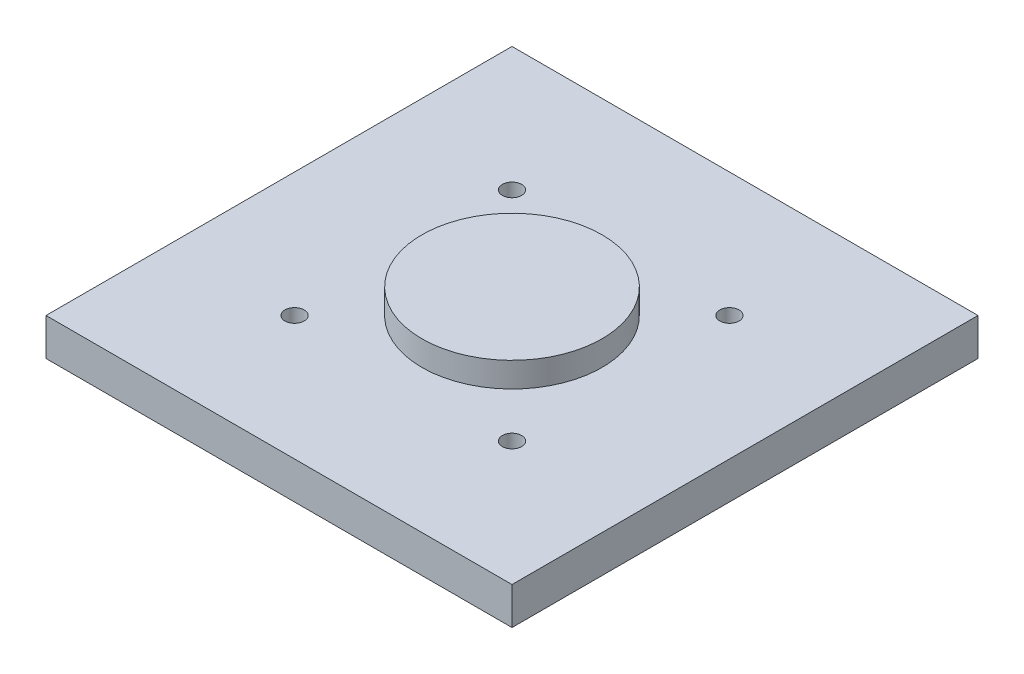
SolidWorks part; units mm, degrees
ref_plane "Plan de face" through (0, 0, 0) normal (0, 0, 1) x (1, 0, 0)
ref_plane "Plan de dessus" through (0, 0, 0) normal (0, 1, 0) x (1, 0, 0)
ref_plane "Plan de droite" through (0, 0, 0) normal (1, 0, 0) x (0, 0, -1)
sketch "Esquisse1" plane through (0, 0, 0) normal (0, 0, 1) x (1, 0, 0)
  line L1 (32.6923, -652.6923) -> (-342.3077, -652.6923)
  line L2 (32.6923, -652.6923) -> (32.6923, -682.6923)
  line L3 (32.6923, -682.6923) -> (-342.3077, -682.6923)
  line L4 (-342.3077, -652.6923) -> (-342.3077, -682.6923)
  line L5 (32.6923, -652.6923) -> (-342.3077, -682.6923) construction
  line L6 (32.6923, -682.6923) -> (-342.3077, -652.6923) construction
  point P0 (-154.8077, -667.6923)
  dimension "D1" = 30
  dimension "D2" = 375
extrude "Boss.-Extru.1" add sketch "Esquisse1" along normal blind 375
hole_wizard "Dégagement M141" positions "Esquisse12" profile "Esquisse9" hole size "M14" standard "ISO"
sketch "Esquisse12" plane through (0, -652.6923, 0) normal (0, 1, 0) x (1, 0, 0)
  line L0 (32.6923, -375) -> (32.6923, 0) construction
  line L1 (32.6923, -375) -> (-342.3077, -375) construction
  line L2 (32.6923, 0) -> (-342.3077, 0) construction
  line L3 (-342.3077, -375) -> (-342.3077, 0) construction
  point P0 (-67.3077, -100)
  point P2 (-242.3077, -100)
  point P4 (-242.3077, -275)
  point P6 (-67.3077, -275)
  dimension "D1" = 100
  dimension "D2" = 100
  dimension "D3" = 100
  dimension "D4" = 100
  dimension "D5" = 100
  dimension "D6" = 100
  dimension "D7" = 100
  dimension "D8" = 100
sketch "Esquisse9" plane through (-67.3077, -652.6923, 100) normal (1, 0, 0) x (0, 0, 1)
  line L0 (0, 0) -> (0, 30)
  line L1 (0, 30) -> (7.75, 30)
  line L2 (7.75, 30) -> (7.75, 0)
  line L5 (7.75, 0) -> (0, 0)
  line L11 (0, -6.35) -> (0, 107.95) construction
  dimension "Diamètre du perçage jusqu'au prochain" = 15.5
  dimension "Profondeur du perçage jusqu'au prochain" = 30
sketch "Esquisse15" plane through (0, -652.6923, 0) normal (0, 1, 0) x (1, 0, 0)
  line L0 (-154.8077, 0) -> (-154.8077, -375)
  line L1 (32.6923, 0) -> (-342.3077, 0) construction
  line L2 (32.6923, -375) -> (-342.3077, -375) construction
  circle A0 centre (-154.8077, -187.5) radius 72.5
  dimension "D1" = 145
extrude "Boss.-Extru.2" add sketch "Esquisse15" along normal blind 20 contours L0 A0 | L0 A0
